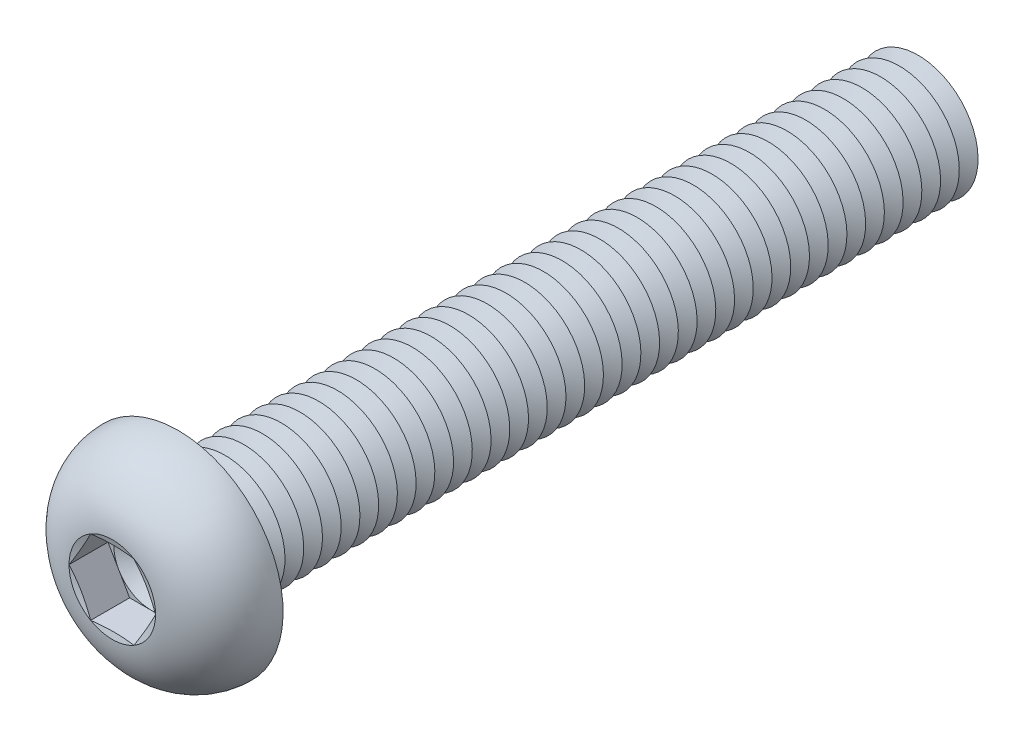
SolidWorks part; units mm, degrees
ref_plane "Front Plane" through (0, 0, 0) normal (0, 0, 1) x (1, 0, 0)
ref_plane "Top Plane" through (0, 0, 0) normal (0, 1, 0) x (1, 0, 0)
ref_plane "Right Plane" through (0, 0, 0) normal (1, 0, 0) x (0, 0, -1)
sketch "Sketch1" plane through (0, 0, 0) normal (1, 0, 0) x (0, 0, -1)
  line L0 (0, 4) -> (0, 7)
  line L3 (0, 4) -> (50, 4)
  line L4 (50, 4) -> (50, 0)
  line L5 (50, 0) -> (-4.4, 0) construction
  line L6 (-4.4, 0) -> (50, 0)
  line L7 (-4.4, 2.8867) -> (-4.4, 1.4434) construction
  line L8 (-4.4, 1.4434) -> (-4.4, 0)
  line L9 (-4.4, 2.8867) -> (-4.0132, 1.4434)
  line L10 (-4.0132, 1.4434) -> (-4.4, 1.4434)
  line L11 (50, 0) -> (22.7481, 0) construction
  line L12 (0, 7) -> (-4.4, 7) construction
  arc A1 (0, 7) -> (-4.4, 2.8867) centre (0, 2.59) ccw
  point P8 (50, 2)
  dimension "D1" = 14
  dimension "D2" = 8
  dimension "D3" = 4.4
  dimension "D4" = 5.7735
  dimension "D5" = 50
  dimension "D6" = 15
revolve "Revolve1" add sketch "Sketch1" angle 360 about L5
fillet "Fillet1" radius 0.625 1 edges at (0, 4, 0)
sketch "Sketch2" plane through (0, 0, 0) normal (1, 0, 0) x (0, 0, -1)
  line L0 (49.375, 4) -> (50.625, 4)
  line L1 (50, 4) -> (0.625, 4) construction
  line L2 (50.625, 4) -> (50, 2.9175)
  line L3 (50, -4) -> (50, 4) construction
  line L4 (50, 2.9175) -> (49.375, 4)
  dimension "D1" = 1.25
revolve "Cut-Revolve1" cut sketch "Sketch2" angle 360 about axis through (0, 0, -50) along (0, 0, -1)
pattern_linear "LPattern1" count 40 spacing 1.25 along (0, 0, 1) of "Cut-Revolve1"
sketch "Sketch3" plane through (0, 0, 4.4) normal (0, 0, 1) x (1, 0, 0)
  line L7 (1.4434, 2.5) -> (-1.4434, 2.5)
  line L8 (-1.4434, 2.5) -> (-2.8867, 0)
  line L9 (-2.8867, 0) -> (-1.4434, -2.5)
  line L10 (-1.4434, -2.5) -> (1.4434, -2.5)
  line L11 (1.4434, -2.5) -> (2.8867, 0)
  line L12 (2.8867, 0) -> (1.4434, 2.5)
  circle A0 centre (0, 0) radius 2.5 construction
  circle A3 centre (0, 0) radius 2.8867 construction
extrude "Cut-Extrude1" cut sketch "Sketch3" against normal blind 2.6
sketch "Sketch4" plane through (0, 0, 1.8) normal (0, 0, 1) x (1, 0, 0)
  line L1 (1.4434, 2.5) -> (-1.4434, 2.5) construction
  circle A0 centre (0, 0) radius 2.5
extrude "Cut-Extrude2" cut sketch "Sketch4" against normal through all draft 60
